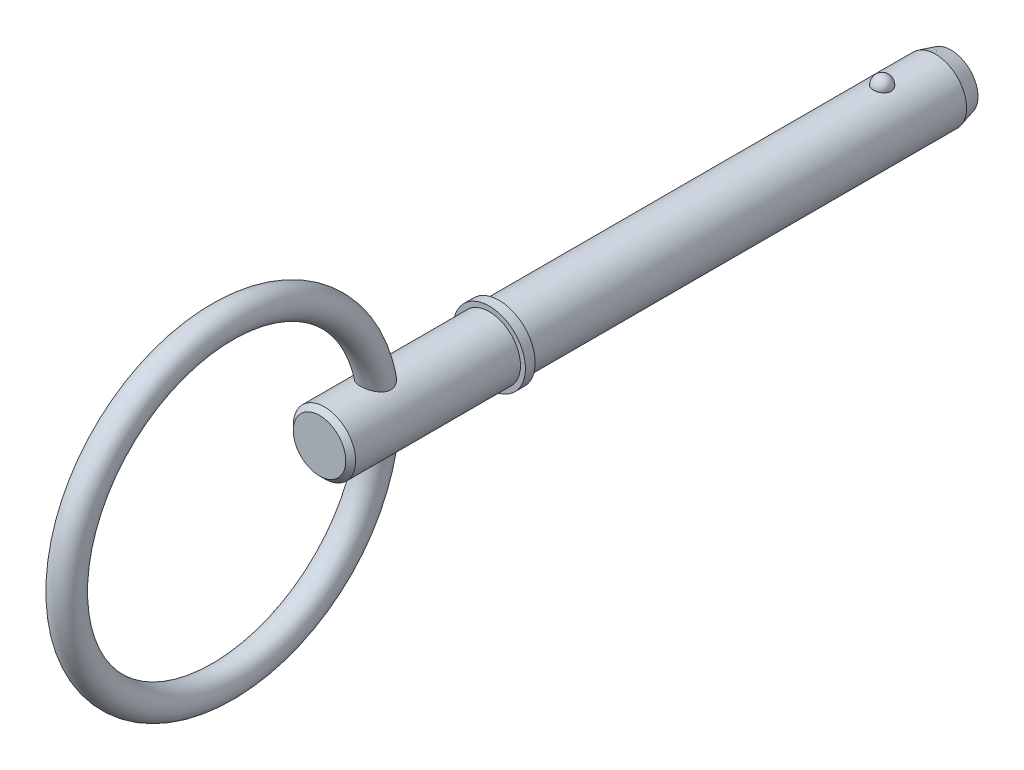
SolidWorks part; units mm, degrees
ref_plane "Front Plane" through (0, 0, 0) normal (0, 0, 1) x (1, 0, 0)
ref_plane "Top Plane" through (0, 0, 0) normal (0, 1, 0) x (1, 0, 0)
ref_plane "Right Plane" through (0, 0, 0) normal (1, 0, 0) x (0, 0, -1)
sketch "Sketch2" plane through (0, 0, 0) normal (0, 0, 1) x (1, 0, 0)
  circle A0 centre (0, 0) radius 3.175
  point P3 (0, 3.175)
  dimension "D1" = 6.35
extrude "Boss-Extrude1" add sketch "Sketch2" along normal blind 38.1
sketch "Sketch3" plane through (0, 0, 0) normal (0, 0, -1) x (-1, 0, 0)
  circle A0 centre (0, 0) radius 3.175
  dimension "D1" = 6.35
extrude "Boss-Extrude2" add sketch "Sketch3" along normal blind 7.92
chamfer "Chamfer1" distance 1.586 angle 15 1 edges at (-3.175, 0, -7.92)
sketch "Sketch18" plane through (0, 0, 0) normal (1, 0, 0) x (0, 0, -1)
  line L0 (6.334, 3.175) -> (-38.1, 3.175) construction
  line L1 (0.91, 4.085) -> (0.91, 2.265)
  line L2 (-38.1, -3.175) -> (6.334, -3.175) construction
  arc A0 (0.91, 4.085) -> (0.91, 2.265) centre (0.91, 3.175) ccw
  point P4 (0, 3.175)
  dimension "D1" = 7.26
revolve "Revolve1" add sketch "Sketch18" angle 360 about L1
sketch "Sketch19" plane through (0, 0, 0) normal (1, 0, 0) x (0, 0, -1)
  line L0 (-33.7288, 0) -> (-46.4542, 0) construction
sketch "Sketch20" plane through (0, 0, 0) normal (1, 0, 0) x (0, 0, -1)
  line L0 (-38.1, 0) -> (-38.1, 3.675)
  line L1 (-38.1, 3.175) -> (-38.1, -3.175) construction
  line L2 (-38.1, 3.675) -> (-39.1, 3.675)
  line L3 (-39.1, 3.675) -> (-39.1, 0)
  line L4 (-33.7288, 0) -> (-46.4542, 0) construction
  line L5 (-39.1, 0) -> (-38.1, 0)
  dimension "D1" = 3.675
  dimension "D2" = 1
revolve "Revolve2" add sketch "Sketch20" angle 360 about L0
sketch "Sketch21" plane through (0, 0, 38.1) normal (0, 0, -1) x (-1, 0, 0)
  circle A0 centre (0, 0) radius 3.175
  dimension "D1" = 6.35
extrude "Boss-Extrude3" add sketch "Sketch21" against normal blind 18.29
chamfer "Chamfer2" distance 0.5 angle 45 1 edges at (-3.175, 0, 56.39)
sketch "Sketch23" plane through (0, 0, 0) normal (1, 0, 0) x (0, 0, -1)
  line L0 (-56.39, 2.675) -> (-56.39, -2.675) construction
  circle A0 centre (-66.265, 0) radius 15.875
  point P2 (-50.39, 0)
  dimension "D1" = 31.75
  dimension "D2" = 6
sketch "Sketch24" plane through (0, 0, 0) normal (0, 1, 0) x (1, 0, 0)
  circle A0 centre (0, -50.39) radius 1.5
  dimension "D1" = 3
sweep "Sweep1" add profiles "Sketch24" path "Sketch23"
